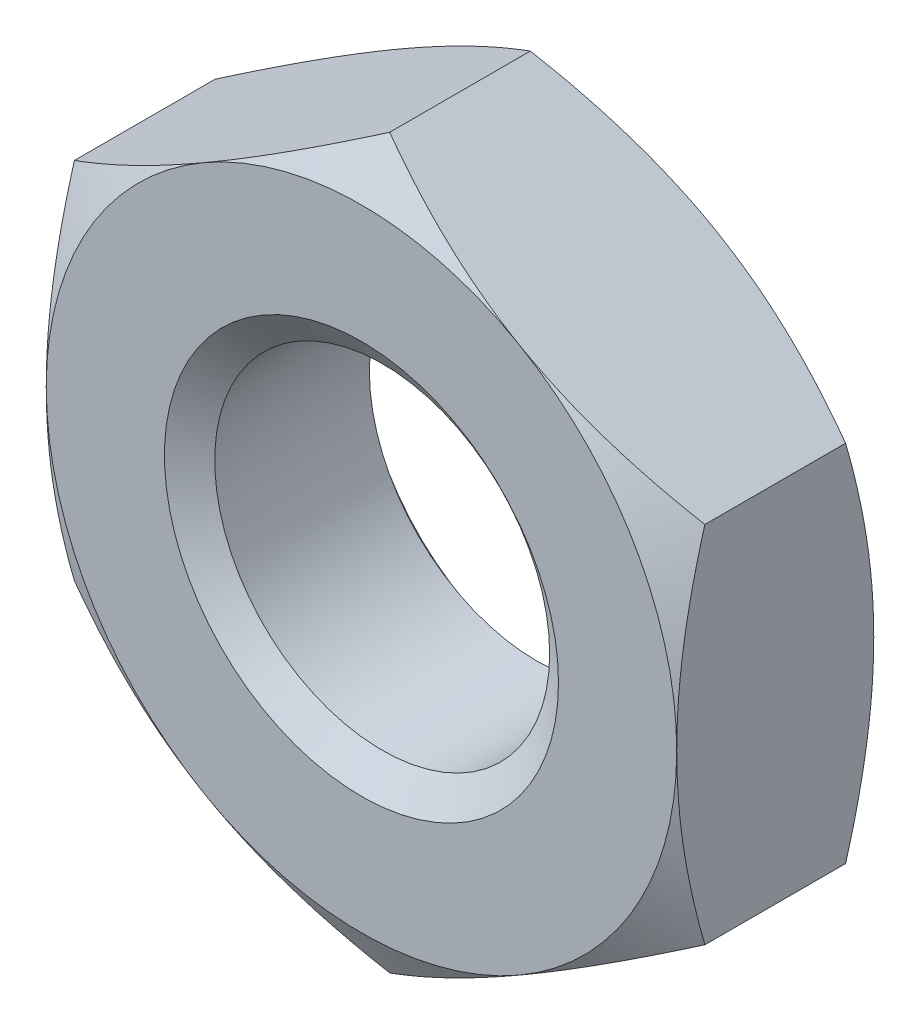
SolidWorks part; units mm, degrees
ref_plane "Plane1" through (0, 0, 0) normal (0, 0, 1) x (1, 0, 0)
ref_plane "Plane2" through (0, 0, 0) normal (0, 1, 0) x (1, 0, 0)
ref_plane "Plane3" through (0, 0, 0) normal (1, 0, 0) x (0, 0, -1)
revolve "EndChamfer" cut sketch "Sketch5"
sketch "Sketch5"
  line L0 (4.9746, 5) -> (4.3969, 4.175)
  line L1 (5.0254, 5) -> (4.9746, 5)
  line L2 (5.0254, 5) -> (5.0254, 4.175)
  line L3 (5.0254, 4.175) -> (4.3969, 4.175)
  line L6 (-0.0508, 5) -> (0, 5)
  line L7 (0, 5) -> (0.5777, 4.175)
  line L9 (0.5777, 4.175) -> (-0.0508, 4.175)
  line L10 (-0.0508, 4.175) -> (-0.0508, 5)
  line L11 (25.0375, 0) -> (38.388, 0) construction
  line L12 (5, 0) -> (0, 0) construction
extrude "BaseNut" add sketch "BaseNutSke" against normal blind 5
sketch "BaseNutSke" plane through (0, 0, 0) normal (0, 0, 1) x (1, 0, 0)
  line L6 (8, 4.6188) -> (8, -4.6188)
  line L7 (-8, 4.6188) -> (-8, -4.6188)
  line L8 (8, 4.6188) -> (0, 9.2376)
  line L9 (0, 9.2376) -> (-8, 4.6188)
  line L10 (-8, -4.6188) -> (0, -9.2376)
  line L11 (0, -9.2376) -> (8, -4.6188)
  circle A0 centre (0, 0) radius 4.25
  dimension "D4" = 8
  dimension "Tap_drill" = 8.5
  dimension "D1" = 120
  dimension "D2" = 8
  dimension "D3" = 8
  dimension "Width_flats" = 16
pattern_linear "ThdSchPat" [suppressed]
revolve "ThreadSchematic" cut sketch "ThdSchSke" angle 360 about L11
sketch "ThdSchSke" plane through (0, 0, 0) normal (0, 1, 0) x (1, 0, 0)
  line L0 (-5, 0.0254) -> (-4.25, 0.5506)
  line L1 (-4.25, 0.5506) -> (-2.125, 0.5506)
  line L2 (-2.125, 0.5506) -> (-2.125, -0.4998)
  line L3 (-2.125, -0.4998) -> (-4.25, -0.4998)
  line L4 (-4.25, -0.4998) -> (-5, 0.0254)
  line L5 (-3.175, 1.5) -> (3.175, 1.5) construction
  line L6 (0, 1.5) -> (0, -2.9874) construction
  line L7 (0, 4.4494) -> (0, 0.5252) construction
  dimension "D1" = 35
  dimension "VeeAngle" = 70
  dimension "SideAngle" = 55
  dimension "D2" = 0.0508
  dimension "OverCut" = 4.25
  dimension "Tap_Drill" = 8.5
  dimension "Advance" = 1.2373
  dimension "Thread_major" = 10
  dimension "Num_threads" = 5
  dimension "D4" = 50
  dimension "Offset1" = 5.0254
  dimension "ThreadMajor" = 5
  dimension "ChamferDepth" = 0.825
  dimension "Offset2" = 5.0762
sketch "Sketch4" plane through (0, 0, 0) normal (1, 0, 0) x (0, 0, -1)
  line L0 (5, 8) -> (4.99, 8)
  line L1 (5, 8) -> (5, 19.2376)
  line L2 (4.99, 19.2376) -> (5, 19.2376)
  line L3 (4.99, 19.2376) -> (4.99, 8)
  line L4 (0, 0) -> (34.925, 0) construction
  line L6 (5, 4.6188) -> (5, 9.2376) construction
  line L7 (0, 8) -> (-10, 8)
  line L8 (0, 4.6188) -> (0, 9.2376) construction
  line L9 (0.7145, 9.2376) -> (0.7145, 19.2376)
  line L10 (0.7145, 19.2376) -> (-10, 19.2376)
  line L11 (-10, 19.2376) -> (-10, 8)
  line L12 (0, 8) -> (0.7145, 9.2376)
  line L14 (0, 4.6188) -> (0, -4.6188) construction
  line L15 (5, 9.2376) -> (0, 9.2376) construction
  dimension "D1" = 8
  dimension "D2" = 30
  dimension "Bearing_ht" = 0.01
  dimension "D3" = 10
  dimension "D4" = 10
revolve "Bearing-Face" [suppressed] cut sketch "Sketch4" angle 360 about L4
sketch "Sketch3" plane through (0, 0, 0) normal (1, 0, 0) x (0, 0, -1)
  line L0 (5, 8) -> (4.2855, 9.2376)
  line L1 (4.2855, 9.2376) -> (4.2855, 19.2376)
  line L2 (4.2855, 19.2376) -> (15, 19.2376)
  line L3 (15, 19.2376) -> (15, 8)
  line L4 (15, 8) -> (5, 8)
  line L5 (5, 4.6188) -> (5, 9.2376) construction
  line L6 (5, 9.2376) -> (0, 9.2376) construction
  line L7 (0, 0) -> (38.6776, 0) construction
  line L8 (5, 0) -> (0, 0) construction
  line L9 (2.5, 9.2376) -> (2.5, 44.222) construction
  line L10 (0.7145, 19.2376) -> (-10, 19.2376)
  line L11 (-10, 19.2376) -> (-10, 8)
  line L12 (-10, 8) -> (0, 8)
  line L13 (0, 8) -> (0.7145, 9.2376)
  line L14 (0.7145, 9.2376) -> (0.7145, 19.2376)
  line L16 (5, 9.2376) -> (0, 9.2376) construction
  dimension "D1" = 8
  dimension "D2" = 30
  dimension "D3" = 10
  dimension "D4" = 10
revolve "Double-Chamfer" cut sketch "Sketch3" angle 360 about L7
equation "\"D2@BaseNutSke\" = \"Width_flats@BaseNutSke\" / 2"
equation "\"D3@BaseNutSke\" = \"Width_flats@BaseNutSke\" / 2"
equation "\"D1@Sketch3\" = \"Width_flats@BaseNutSke\" /2"
equation "\"D1@Sketch4\" = \"D2@BaseNutSke\""
equation "\"D4@BaseNutSke\" = \"D3@BaseNutSke\""
equation "\"Thread_major@ThdSchSke\" = \"Thread_major@ThreadCosmetic\""
equation "\"Tap_drill@ThdSchSke\" = \"Tap_drill@BaseNutSke\""
equation "\"Overcut@ThdSchSke\" = \"Tap_drill@ThdSchSke\" * 0.5"
equation "\"Num_threads@ThdSchPat\" = int(  ( \"Thickness@BaseNut\" - 0.0508 ) / \"Advance@ThdSchSke\" + 0.999 )  + 1"
equation "\"Advance@ThdSchPat\" = ( \"Thickness@BaseNut\" - 0.0508 ) /  (\"Num_threads@ThdSchPat\" - 1) 'relax it"
equation "' \"Num_threads@ThdSchPat\" = \"Num_threads@ThdSchPat\" - sgn( \"Num_threads@ThdSchPat\" - 1) '---chamfered tips only---"
equation "\"ThreadMajor@Sketch5\" = \"Thread_major@ThreadCosmetic\" * 0.5"
equation "\"ChamferDepth@Sketch5\" = (\"Thread_major@ThreadCosmetic\" - \"Tap_drill@BaseNutSke\") * 0.55"
equation "\"Offset1@Sketch5\" = \"Thickness@BaseNut\" + 0.0254"
equation "\"Offset2@Sketch5\" = \"Offset1@Sketch5\" + 0.0508"
